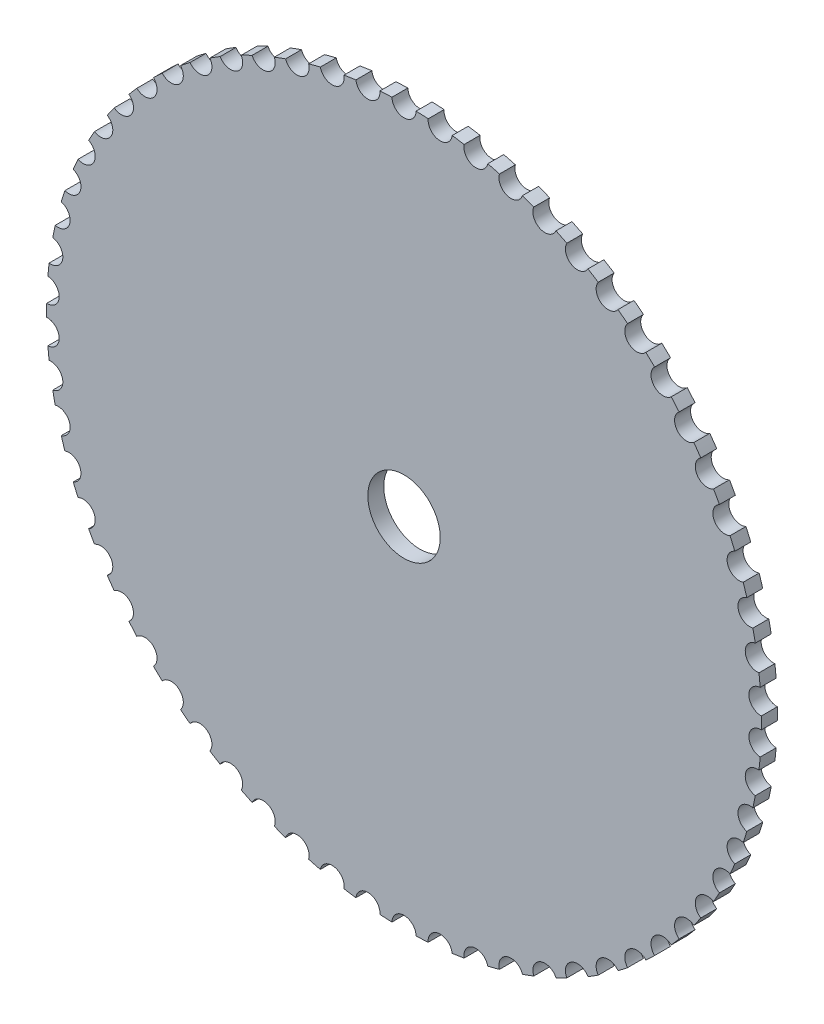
SolidWorks part; units mm, degrees
ref_plane "Front Plane" through (0, 0, 0) normal (0, 0, 1) x (1, 0, 0)
ref_plane "Top Plane" through (0, 0, 0) normal (0, 1, 0) x (1, 0, 0)
ref_plane "Right Plane" through (0, 0, 0) normal (1, 0, 0) x (0, 0, -1)
sketch "Sketch1" plane through (0, 0, 0) normal (0, 0, 1) x (1, 0, 0)
  line L0 (0, 0) -> (0, 93.98) construction
  circle A0 centre (0, 0) radius 9.525
  circle A1 centre (0, 0) radius 93.98
  dimension "D1" = 19.05
  dimension "D2" = 187.96
extrude "Extrude1" add sketch "Sketch1" along normal mid plane 4.191
sketch "Sketch2" plane through (0, 0, -2.0955) normal (0, 0, -1) x (-1, 0, 0)
  line L0 (0, 0) -> (0, 90.805) construction
  arc A0 (-3.1745, 93.9264) -> (3.1745, 93.9264) centre (0, 93.98) ccw
  circle A1 centre (0, 0) radius 93.98 construction
  arc A2 (3.1745, 93.9264) -> (-3.1745, 93.9264) centre (0, 0) ccw
  dimension "D1" = 3.175
  dimension "D2" = 90.805
extrude "Extrude2" cut sketch "Sketch2" against normal up to next
pattern_circular "CirPattern1" count 62 over 360 about axis through (0, 0, 0) along (0, 0, 1) of "Extrude2"
